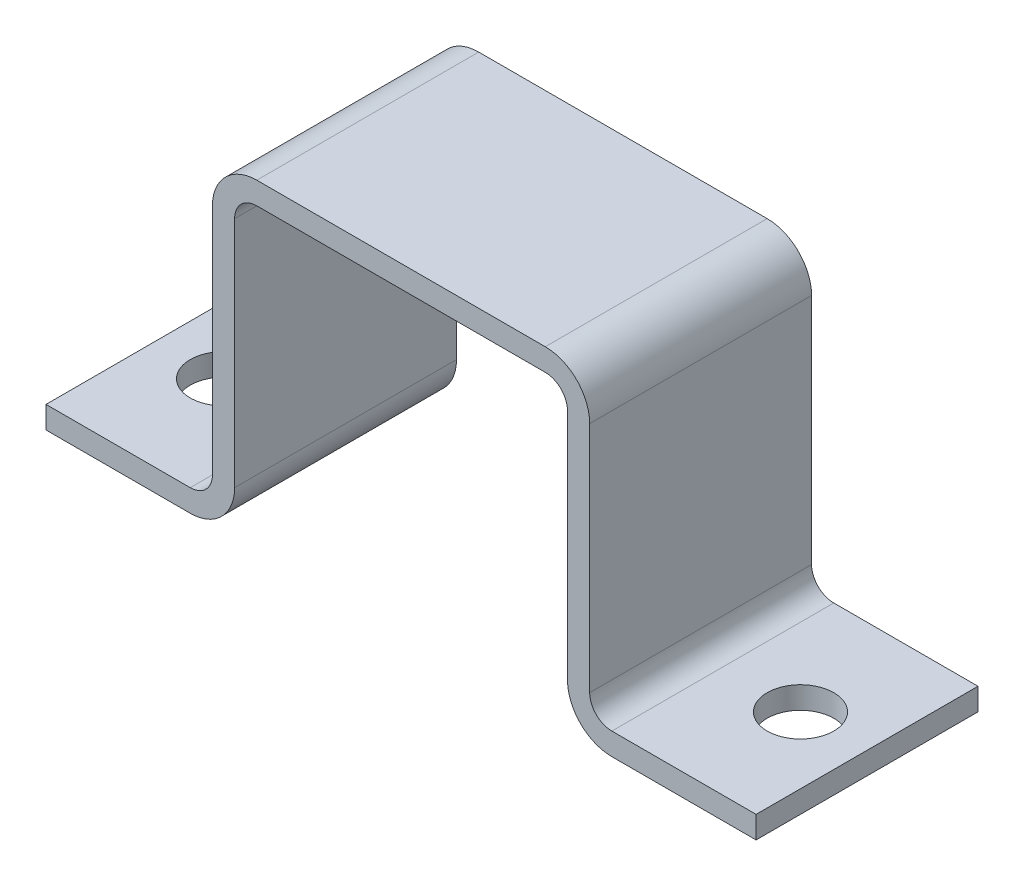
SolidWorks part; units mm, degrees
ref_plane "Plan de face" through (0, 0, 0) normal (0, 0, 1) x (1, 0, 0)
ref_plane "Plan de dessus" through (0, 0, 0) normal (0, 1, 0) x (1, 0, 0)
ref_plane "Plan de droite" through (0, 0, 0) normal (1, 0, 0) x (0, 0, -1)
sketch "Esquisse1" plane through (0, 0, 0) normal (0, 0, 1) x (1, 0, 0)
  line L0 (0, 0) -> (17, 0)
  line L1 (17, 0) -> (17, 27)
  line L2 (17, 27) -> (47, 27)
  line L3 (47, 27) -> (47, 0)
  line L4 (47, 0) -> (64, 0)
  line L5 (64, 0) -> (64, 2)
  line L6 (64, 2) -> (49, 2)
  line L7 (49, 2) -> (49, 29)
  line L8 (49, 29) -> (15, 29)
  line L9 (15, 29) -> (15, 2)
  line L10 (15, 2) -> (0, 2)
  line L11 (0, 2) -> (0, 0)
  dimension "D1" = 2
  dimension "D2" = 2
  dimension "D3" = 2
  dimension "D4" = 2
  dimension "D5" = 2
  dimension "D6" = 30
  dimension "D7" = 27
  dimension "D8" = 15
  dimension "D9" = 15
extrude "Extrusion1" add sketch "Esquisse1" along normal blind 20
fillet "Congé1" radius 2 4 edges at (49, 2, 10) (47, 27, 10) (17, 27, 10) (15, 2, 10)
fillet "Congé2" radius 4 4 edges at (17, 0, 10) (47, 0, 10) (49, 29, 10) (15, 29, 10)
sketch "Esquisse2" plane through (0, 2, 0) normal (0, 1, 0) x (-1, 0, 0)
  line L0 (-64, 20) -> (-64, 0) construction
  line L1 (0, 20) -> (0, 0) construction
  line L2 (-64, 0) -> (-51, 0) construction
  line L3 (-13, 0) -> (0, 0) construction
  circle A0 centre (-58, 10) radius 3
  circle A1 centre (-6, 10) radius 3
  dimension "D1" = 6
  dimension "D2" = 6
  dimension "D5" = 10
  dimension "D6" = 10
  dimension "D3" = 6
  dimension "D4" = 6
extrude "Enlèv. mat.-Extru.1" cut sketch "Esquisse2" against normal through all
